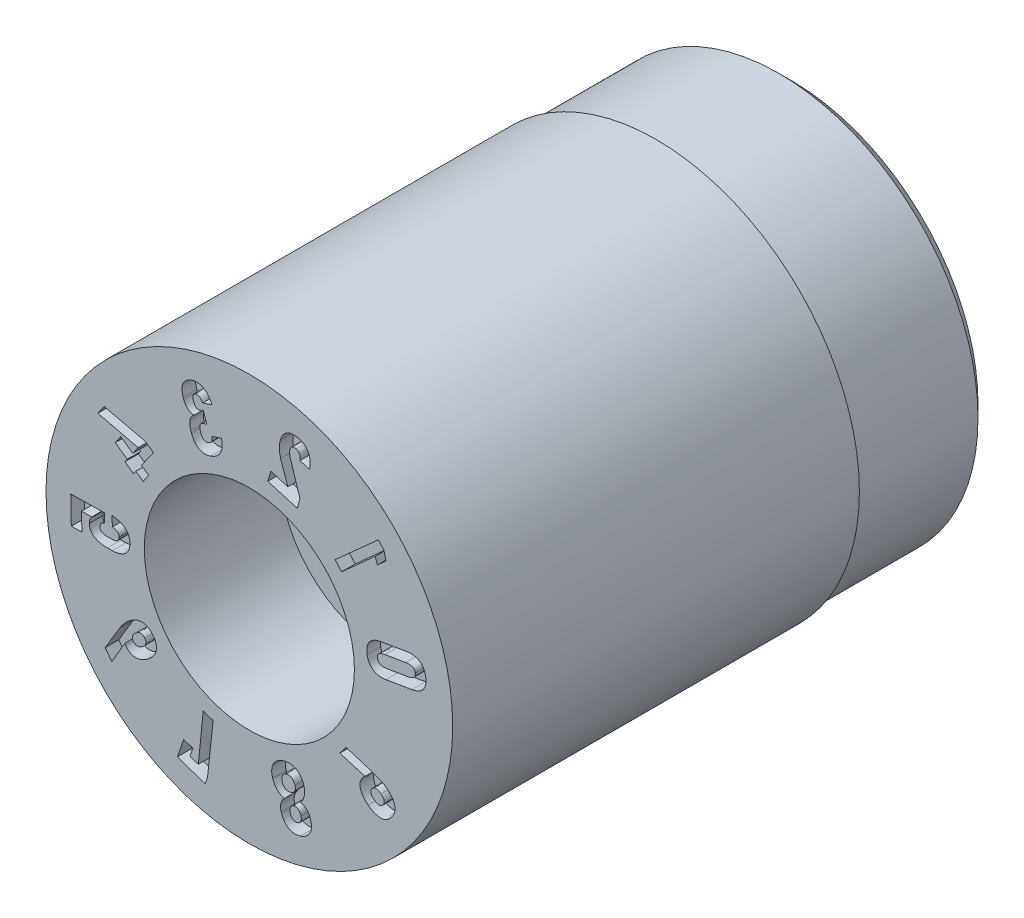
SolidWorks part; units mm, degrees
ref_plane "Front Plane" through (0, 0, 0) normal (0, 0, 1) x (1, 0, 0)
ref_plane "Top Plane" through (0, 0, 0) normal (0, 1, 0) x (1, 0, 0)
ref_plane "Right Plane" through (0, 0, 0) normal (1, 0, 0) x (0, 0, -1)
sketch "Sketch1" plane through (0, 0, 0) normal (1, 0, 0) x (0, 0, -1)
  line L2 (0, 3) -> (0, 1.55)
  line L3 (7.75, 3) -> (0, 3)
  line L4 (-3.7979, 0) -> (49996.2021, 0) construction
  line L8 (8, 0.8) -> (2, 0.8)
  line L9 (2, 1.55) -> (2, 0.8)
  line L10 (2, 1.55) -> (0, 1.55)
  line L12 (8, 0.8) -> (8, 2.75)
  line L16 (8, 2.75) -> (7.75, 3)
  dimension "D1" = 8
  dimension "D2" = 45
  dimension "D3" = 0.25
  dimension "D4" = 6
  dimension "D5" = 3.1
  dimension "D6" = 2
  dimension "D7" = 1.6
revolve "Revolve1" add sketch "Sketch1" angle 360 about L4
sketch "Sketch4" plane through (0, 0, 0) normal (1, 0, 0) x (0, 0, -1)
  line L0 (0, 0) -> (50000, 0) construction
  line L1 (8, -2.75) -> (8, 2.75) construction
  line L2 (6, 3.935) -> (8, 3.935)
  line L3 (6, 3.935) -> (6, 2.935)
  line L4 (6, 2.935) -> (8, 2.935)
  line L5 (8, 3.935) -> (8, 2.935)
  line L6 (7.75, 3) -> (0, 3) construction
  line L9 (0, 55) -> (0, -55) construction
  dimension "D1" = 1
  dimension "D2" = 0.065
  dimension "D3" = 6
revolve "Cut-Revolve1" cut sketch "Sketch4" angle 360 about L0
sketch "Sketch6" plane through (0, 0, 0) normal (0, 0, 1) x (1, 0, 0)
  line L0 (2.0146, 0.1055) -> (2.3985, 0.1693)
  line L1 (2.3238, 0.6173) -> (1.9399, 0.5535)
  line L2 (2.0042, 0.4192) -> (2.3067, 0.4695)
  line L3 (2.3344, 0.3037) -> (2.0318, 0.2534)
  line L4 (1.2659, 1.2629) -> (1.3617, 1.1564)
  line L5 (1.3617, 1.1564) -> (1.8572, 1.6021)
  line L6 (1.8572, 1.6021) -> (1.8898, 1.5069)
  line L7 (1.8898, 1.5069) -> (2.017, 1.6214)
  line L8 (2.017, 1.6214) -> (1.984, 1.7445)
  line L9 (1.984, 1.7445) -> (1.9023, 1.8354)
  line L10 (1.9023, 1.8354) -> (1.2659, 1.2629)
  line L11 (0.7471, 1.7823) -> (0.6045, 2.2294)
  line L12 (0.5981, 2.3405) -> (0.5985, 2.3418)
  line L13 (0.7452, 2.2693) -> (0.745, 2.2687)
  line L14 (0.745, 2.2687) -> (0.8866, 2.2273)
  line L15 (0.8866, 2.2273) -> (0.8868, 2.228)
  line L16 (0.4577, 2.3877) -> (0.4575, 2.387)
  line L17 (0.4616, 2.1553) -> (0.567, 1.8452)
  line L18 (0.567, 1.8452) -> (0.3165, 1.9181)
  line L19 (0.3165, 1.9181) -> (0.2727, 1.7677)
  line L20 (0.2727, 1.7677) -> (0.7061, 1.6415)
  line L21 (0.7061, 1.6415) -> (0.7471, 1.7823)
  line L22 (-0.4143, 1.9759) -> (-0.5539, 1.9282)
  line L23 (-0.7144, 1.8887) -> (-0.721, 1.9077)
  line L24 (-0.6885, 2.0268) -> (-0.6279, 2.0476)
  line L25 (-0.6279, 2.0476) -> (-0.6784, 2.1951)
  line L26 (-0.6784, 2.1951) -> (-0.739, 2.1743)
  line L27 (-0.8213, 2.2398) -> (-0.826, 2.2537)
  line L28 (-0.6895, 2.2872) -> (-0.5503, 2.3348)
  line L29 (-0.9763, 2.2198) -> (-0.968, 2.195)
  line L30 (-0.8618, 1.8465) -> (-0.8533, 1.8218)
  line L31 (-1.5375, 1.3759) -> (-2.1429, 1.5153)
  line L32 (-2.1429, 1.5153) -> (-2.2358, 1.383)
  line L33 (-2.2358, 1.383) -> (-1.6397, 1.2426)
  line L34 (-1.6397, 1.2426) -> (-1.7192, 1.1295)
  line L35 (-1.8355, 0.9639) -> (-1.7082, 0.8747)
  line L36 (-1.7082, 0.8747) -> (-1.6741, 0.9233)
  line L37 (-1.416, 1.2908) -> (-1.5375, 1.3759)
  line L38 (-1.8965, 1.2539) -> (-1.9785, 1.1368)
  line L39 (-1.9785, 1.1368) -> (-1.8013, 1.0125)
  line L40 (-1.5662, 0.8476) -> (-1.4841, 0.9646)
  line L41 (-1.4841, 0.9646) -> (-1.5919, 1.0402)
  line L42 (-2.0239, 0.1805) -> (-2.0244, 0.1805)
  line L43 (-2.0244, 0.1805) -> (-2.0215, 0.038)
  line L44 (-2.0215, 0.038) -> (-2.021, 0.0381)
  line L45 (-2.0242, -0.122) -> (-2.0962, -0.1234)
  line L46 (-2.1379, 0.0281) -> (-2.1406, 0.1613)
  line L47 (-2.1406, 0.1613) -> (-2.6351, 0.1512)
  line L48 (-2.6351, 0.1512) -> (-2.6268, -0.2552)
  line L49 (-2.6268, -0.2552) -> (-2.4707, -0.2519)
  line L50 (-2.4707, -0.2519) -> (-2.476, 0.012)
  line L51 (-2.476, 0.012) -> (-2.324, 0.0152)
  line L52 (-2.0933, -0.2659) -> (-2.0213, -0.2645)
  line L53 (-1.7593, -1.0269) -> (-1.7598, -1.0271)
  line L54 (-1.9203, -1.2119) -> (-2.1265, -1.5571)
  line L55 (-2.1265, -1.5571) -> (-2.0299, -1.6877)
  line L56 (-2.0299, -1.6877) -> (-1.8358, -1.3565)
  line L58 (-1.4966, -1.3877) -> (-1.4961, -1.3873)
  line L59 (-1.5735, -1.2658) -> (-1.574, -1.2662)
  line L60 (-1.6681, -1.1381) -> (-1.6676, -1.1377)
  line L61 (-0.6171, -2.458) -> (-0.5345, -1.6928)
  line L62 (-0.5345, -1.6928) -> (-0.6809, -1.6428)
  line L63 (-0.6809, -1.6428) -> (-0.7525, -2.3604)
  line L64 (-0.7525, -2.3604) -> (-0.8756, -2.3182)
  line L65 (-0.8756, -2.3182) -> (-0.8338, -2.1959)
  line L66 (-0.8338, -2.1959) -> (-0.9689, -2.1498)
  line L67 (-0.9689, -2.1498) -> (-1.0613, -2.4195)
  line L68 (-1.0613, -2.4195) -> (-0.6519, -2.5595)
  line L69 (-0.6519, -2.5595) -> (-0.6171, -2.458)
  line L70 (0.3422, -1.9837) -> (0.3462, -1.9971)
  line L71 (0.4686, -2.3516) -> (0.475, -2.3731)
  line L72 (0.9048, -2.2444) -> (0.8983, -2.2229)
  line L73 (0.8059, -1.8597) -> (0.8018, -1.8462)
  line L74 (0.6721, -1.9095) -> (0.6744, -1.9175)
  line L75 (0.4878, -1.9728) -> (0.4852, -1.9642)
  line L76 (0.7598, -2.2576) -> (0.7621, -2.2655)
  line L77 (0.6057, -2.3119) -> (0.6031, -2.3035)
  line L79 (1.7522, -1.6284) -> (1.7529, -1.6288)
  line L80 (2.0233, -1.2728) -> (2.0226, -1.2724)
  line L81 (1.8037, -1.1717) -> (1.427, -1.054)
  line L82 (1.427, -1.054) -> (1.334, -1.1747)
  line L83 (1.334, -1.1747) -> (1.7071, -1.2847)
  line L84 (1.9409, -1.3912) -> (1.9414, -1.3916)
  line L85 (1.8438, -1.5174) -> (1.8433, -1.5169)
  line L86 (-1.7192, 1.1295) -> (-1.8965, 1.2539)
  line L87 (-1.8013, 1.0125) -> (-1.8355, 0.9639)
  line L88 (-1.5919, 1.0402) -> (-1.416, 1.2908)
  line L89 (-1.6741, 0.9233) -> (-1.5662, 0.8476)
  spline S0 degree 3 poles (1.7376, 0.2895) (1.7404, 0.2722) (1.7463, 0.2472) (1.7584, 0.2162) (1.769, 0.1955) (1.7813, 0.1769) (1.7955, 0.1603) (1.8111, 0.1454) (1.8287, 0.1329) (1.8476, 0.1223) (1.8679, 0.1136) (1.8895, 0.1072) (1.9121, 0.1026) (1.9361, 0.1003) (1.9705, 0.0997) (1.9968, 0.1025) (2.0146, 0.1055) knots 0 0 0 0 0.138609 0.202542 0.263351 0.322176 0.379333 0.435855 0.492619 0.54966 0.607664 0.667011 0.72758 0.790746 0.857219 1 1 1 1
  spline S1 degree 3 poles (2.3985, 0.1693) (2.4164, 0.1726) (2.4426, 0.1781) (2.4751, 0.1901) (2.497, 0.2002) (2.5171, 0.2116) (2.5352, 0.225) (2.5516, 0.2396) (2.5659, 0.2559) (2.5784, 0.2735) (2.5883, 0.2926) (2.5962, 0.3129) (2.6017, 0.3346) (2.605, 0.3575) (2.6062, 0.3907) (2.604, 0.4161) (2.601, 0.4333) knots 0 0 0 0 0.144216 0.210853 0.274107 0.334901 0.39402 0.451854 0.508838 0.565474 0.622094 0.678903 0.737674 0.798508 0.862086 1 1 1 1
  spline S2 degree 3 poles (2.601, 0.4333) (2.5982, 0.4505) (2.5923, 0.4755) (2.5803, 0.5064) (2.5696, 0.527) (2.5575, 0.5458) (2.5436, 0.5626) (2.5279, 0.5773) (2.5106, 0.5901) (2.4918, 0.6007) (2.4717, 0.6095) (2.4502, 0.616) (2.4275, 0.6205) (2.4034, 0.6227) (2.3686, 0.6233) (2.3419, 0.6202) (2.3238, 0.6173) knots 0 0 0 0 0.138369 0.201729 0.262433 0.321042 0.378365 0.434789 0.490925 0.547561 0.605122 0.663992 0.724856 0.788333 0.855125 1 1 1 1
  spline S3 degree 3 poles (1.9399, 0.5535) (1.9219, 0.5506) (1.896, 0.5444) (1.8633, 0.5328) (1.8414, 0.5227) (1.8214, 0.5111) (1.8032, 0.4977) (1.7868, 0.4831) (1.7725, 0.4667) (1.7602, 0.449) (1.75, 0.43) (1.7424, 0.4096) (1.737, 0.388) (1.7337, 0.3652) (1.732, 0.332) (1.7349, 0.3066) (1.7376, 0.2895) knots 0 0 0 0 0.144225 0.210871 0.274142 0.335041 0.394175 0.452024 0.509023 0.565947 0.622266 0.679445 0.737977 0.798415 0.862179 1 1 1 1
  spline S4 degree 3 poles (1.8909, 0.3151) (1.8889, 0.3277) (1.8889, 0.3474) (1.9003, 0.3702) (1.9133, 0.3843) (1.9304, 0.3961) (1.9603, 0.4101) (1.986, 0.4159) (2.0042, 0.4192) knots 0 0 0 0 0.222979 0.324818 0.432128 0.549721 0.681516 1 1 1 1
  spline S5 degree 3 poles (2.3067, 0.4695) (2.3249, 0.4726) (2.3511, 0.4749) (2.384, 0.4718) (2.4011, 0.4669) (2.413, 0.4614) (2.4207, 0.4564) (2.4276, 0.4505) (2.4337, 0.4438) (2.4385, 0.4359) (2.4441, 0.4242) (2.4468, 0.4146) (2.4478, 0.4079) knots 0 0 0 0 0.31775 0.449993 0.566884 0.621636 0.673932 0.725322 0.777608 0.829312 0.882944 1 1 1 1
  spline S6 degree 3 poles (2.4478, 0.4079) (2.4497, 0.3953) (2.45, 0.3754) (2.4382, 0.3528) (2.4253, 0.3386) (2.4082, 0.3268) (2.3782, 0.3129) (2.3526, 0.3066) (2.3344, 0.3037) knots 0 0 0 0 0.222795 0.325269 0.43249 0.549986 0.681672 1 1 1 1
  spline S7 degree 3 poles (2.0318, 0.2534) (2.0137, 0.2501) (1.9875, 0.2479) (1.9545, 0.2509) (1.9375, 0.256) (1.9256, 0.2615) (1.9179, 0.2665) (1.911, 0.2723) (1.905, 0.2792) (1.9002, 0.287) (1.8946, 0.2987) (1.892, 0.3083) (1.8909, 0.3151) knots 0 0 0 0 0.317529 0.449767 0.567235 0.621985 0.674279 0.725667 0.776639 0.829319 0.882949 1 1 1 1
  spline S8 degree 3 poles (0.6045, 2.2294) (0.598, 2.2484) (0.5909, 2.2857) (0.5933, 2.3236) (0.5981, 2.3405) knots 0 0 0 0 0.534247 1 1 1 1
  spline S9 degree 3 poles (0.5985, 2.3418) (0.6012, 2.3519) (0.6077, 2.3659) (0.6209, 2.3807) (0.6325, 2.3884) (0.6457, 2.3933) (0.666, 2.3964) (0.6819, 2.393) (0.6924, 2.3902) knots 0 0 0 0 0.261267 0.378259 0.491228 0.605842 0.725733 1 1 1 1
  spline S10 degree 3 poles (0.6924, 2.3902) (0.7031, 2.3874) (0.718, 2.3796) (0.7331, 2.3633) (0.7411, 2.3486) (0.7464, 2.3316) (0.75, 2.3049) (0.7478, 2.2838) (0.7452, 2.2693) knots 0 0 0 0 0.227549 0.335372 0.449552 0.569521 0.698703 1 1 1 1
  spline S11 degree 3 poles (0.8868, 2.228) (0.8923, 2.2527) (0.8981, 2.2894) (0.8976, 2.3376) (0.8934, 2.3707) (0.8856, 2.4016) (0.8744, 2.4301) (0.8594, 2.4558) (0.8412, 2.479) (0.8196, 2.4992) (0.7861, 2.5225) (0.7573, 2.5345) (0.7372, 2.5403) knots 0 0 0 0 0.196419 0.286379 0.372568 0.454609 0.533178 0.609155 0.684941 0.760994 0.837616 1 1 1 1
  spline S12 degree 3 poles (0.7372, 2.5403) (0.716, 2.5466) (0.684, 2.5529) (0.6419, 2.5535) (0.6129, 2.5498) (0.5857, 2.5423) (0.5604, 2.5312) (0.5373, 2.516) (0.5164, 2.4973) (0.4978, 2.4749) (0.4755, 2.4393) (0.464, 2.4089) (0.4577, 2.3877) knots 0 0 0 0 0.183992 0.267932 0.348004 0.425466 0.500914 0.576307 0.653235 0.732785 0.816526 1 1 1 1
  spline S13 degree 3 poles (0.4575, 2.387) (0.4522, 2.3682) (0.4458, 2.3394) (0.4424, 2.3) (0.4421, 2.2701) (0.4434, 2.2404) (0.4487, 2.2017) (0.4555, 2.1735) (0.4616, 2.1553) knots 0 0 0 0 0.249446 0.375439 0.503252 0.630424 0.75523 1 1 1 1
  spline S14 degree 3 poles (-0.5662, 1.6698) (-0.5456, 1.677) (-0.516, 1.6903) (-0.4815, 1.7149) (-0.4592, 1.7358) (-0.44, 1.759) (-0.4246, 1.7846) (-0.4127, 1.8124) (-0.4048, 1.8423) (-0.4007, 1.8739) (-0.401, 1.9192) (-0.4076, 1.9533) (-0.4143, 1.9759) knots 0 0 0 0 0.171218 0.25238 0.331984 0.41001 0.487611 0.565757 0.646215 0.72948 0.815076 1 1 1 1
  spline S15 degree 3 poles (-0.5539, 1.9282) (-0.5523, 1.9199) (-0.5504, 1.9078) (-0.5507, 1.8919) (-0.552, 1.881) (-0.5545, 1.8708) (-0.5583, 1.8614) (-0.563, 1.8528) (-0.5687, 1.845) (-0.5756, 1.8381) (-0.5864, 1.83) (-0.5958, 1.8258) (-0.6022, 1.8235) knots 0 0 0 0 0.197705 0.287546 0.372977 0.4551 0.533273 0.609529 0.685153 0.761273 0.838169 1 1 1 1
  spline S16 degree 3 poles (-0.6022, 1.8235) (-0.6138, 1.8193) (-0.6318, 1.8163) (-0.6551, 1.8201) (-0.6706, 1.827) (-0.6844, 1.8375) (-0.7016, 1.8569) (-0.7097, 1.8756) (-0.7144, 1.8887) knots 0 0 0 0 0.250747 0.363671 0.47608 0.592198 0.715111 1 1 1 1
  spline S17 degree 3 poles (-0.721, 1.9077) (-0.7256, 1.9215) (-0.7309, 1.9417) (-0.7316, 1.968) (-0.729, 1.9846) (-0.7235, 1.9993) (-0.7116, 2.0158) (-0.698, 2.0235) (-0.6885, 2.0268) knots 0 0 0 0 0.314858 0.445549 0.566053 0.676389 0.780184 1 1 1 1
  spline S18 degree 3 poles (-0.739, 2.1743) (-0.7468, 2.1714) (-0.7596, 2.1702) (-0.7757, 2.1754) (-0.7868, 2.1827) (-0.7971, 2.193) (-0.8102, 2.2114) (-0.8173, 2.228) (-0.8213, 2.2398) knots 0 0 0 0 0.211756 0.314428 0.424926 0.546445 0.681798 1 1 1 1
  spline S19 degree 3 poles (-0.826, 2.2537) (-0.8298, 2.2648) (-0.834, 2.2813) (-0.8338, 2.303) (-0.8308, 2.3168) (-0.8255, 2.329) (-0.8144, 2.3429) (-0.8024, 2.3495) (-0.7938, 2.3523) knots 0 0 0 0 0.302293 0.43097 0.549865 0.661575 0.76929 1 1 1 1
  spline S20 degree 3 poles (-0.7938, 2.3523) (-0.788, 2.3546) (-0.7786, 2.3558) (-0.766, 2.3551) (-0.7566, 2.353) (-0.7473, 2.3496) (-0.7382, 2.3447) (-0.7293, 2.3384) (-0.7206, 2.3308) (-0.7121, 2.3219) (-0.7012, 2.3076) (-0.694, 2.2957) (-0.6895, 2.2872) knots 0 0 0 0 0.139786 0.209269 0.280741 0.354739 0.430798 0.511438 0.598094 0.68876 0.7855 1 1 1 1
  spline S21 degree 3 poles (-0.5503, 2.3348) (-0.5602, 2.3575) (-0.5772, 2.3898) (-0.606, 2.4273) (-0.6288, 2.4513) (-0.6534, 2.4712) (-0.6791, 2.4876) (-0.7062, 2.4996) (-0.7342, 2.5077) (-0.7629, 2.5117) (-0.8019, 2.5116) (-0.8308, 2.5055) (-0.8495, 2.499) knots 0 0 0 0 0.196281 0.287022 0.374088 0.45775 0.537568 0.614828 0.691684 0.767965 0.84353 1 1 1 1
  spline S22 degree 3 poles (-0.8495, 2.499) (-0.8645, 2.4937) (-0.886, 2.4847) (-0.9121, 2.4694) (-0.9293, 2.4569) (-0.9443, 2.4429) (-0.9576, 2.4278) (-0.969, 2.4114) (-0.9782, 2.3937) (-0.9855, 2.375) (-0.9905, 2.3554) (-0.9937, 2.3349) (-0.9944, 2.3135) (-0.993, 2.2913) (-0.9886, 2.2595) (-0.9819, 2.2357) (-0.9763, 2.2198) knots 0 0 0 0 0.13652 0.199806 0.260089 0.318559 0.37588 0.432741 0.489598 0.547044 0.6047 0.663664 0.724621 0.788557 0.855145 1 1 1 1
  spline S23 degree 3 poles (-0.968, 2.195) (-0.9618, 2.1774) (-0.9502, 2.152) (-0.9282, 2.1232) (-0.9096, 2.105) (-0.889, 2.0901) (-0.8586, 2.0746) (-0.8335, 2.0687) (-0.8164, 2.0673) knots 0 0 0 0 0.267259 0.393105 0.515919 0.636696 0.755619 1 1 1 1
  spline S24 degree 3 poles (-0.8164, 2.0673) (-0.8239, 2.0622) (-0.8347, 2.0538) (-0.8468, 2.0404) (-0.8549, 2.0298) (-0.8617, 2.0181) (-0.8673, 2.0057) (-0.8721, 1.9925) (-0.8756, 1.9785) (-0.8778, 1.9638) (-0.8792, 1.9485) (-0.8791, 1.9328) (-0.8781, 1.9164) (-0.8758, 1.8996) (-0.8711, 1.876) (-0.8658, 1.8583) (-0.8618, 1.8465) knots 0 0 0 0 0.112274 0.166991 0.222094 0.276289 0.332234 0.389462 0.448853 0.509882 0.572455 0.637014 0.703805 0.77371 0.846042 1 1 1 1
  spline S25 degree 3 poles (-0.8533, 1.8218) (-0.8458, 1.7997) (-0.8321, 1.7686) (-0.8079, 1.7318) (-0.788, 1.7089) (-0.7661, 1.6897) (-0.7422, 1.6745) (-0.7163, 1.6635) (-0.6889, 1.6563) (-0.6599, 1.6533) (-0.6182, 1.6552) (-0.5869, 1.6626) (-0.5662, 1.6698) knots 0 0 0 0 0.18918 0.274847 0.356631 0.435017 0.510694 0.586123 0.66227 0.740496 0.822165 1 1 1 1
  spline S26 degree 3 poles (-1.762, -0.0359) (-1.7624, -0.0165) (-1.7663, 0.0126) (-1.7804, 0.0485) (-1.7942, 0.0735) (-1.8117, 0.0964) (-1.8329, 0.1168) (-1.8575, 0.1347) (-1.8853, 0.1501) (-1.9161, 0.1624) (-1.9621, 0.1755) (-1.9988, 0.1795) (-2.0239, 0.1805) knots 0 0 0 0 0.154698 0.229603 0.304852 0.380725 0.457448 0.537586 0.621218 0.708761 0.800522 1 1 1 1
  spline S27 degree 3 poles (-2.021, 0.0381) (-2.0067, 0.0371) (-1.9863, 0.0338) (-1.9617, 0.024) (-1.9469, 0.0146) (-1.9347, 0.0033) (-1.9231, -0.0147) (-1.9192, -0.0305) (-1.9193, -0.0412) knots 0 0 0 0 0.301165 0.43072 0.553236 0.667758 0.776115 1 1 1 1
  spline S28 degree 3 poles (-1.9193, -0.0412) (-1.9191, -0.0525) (-1.9217, -0.0696) (-1.9334, -0.0888) (-1.9458, -0.1004) (-1.9612, -0.1098) (-1.9872, -0.1196) (-2.0091, -0.1214) (-2.0242, -0.122) knots 0 0 0 0 0.227496 0.334815 0.446114 0.565812 0.694478 1 1 1 1
  spline S29 degree 3 poles (-2.0962, -0.1234) (-2.1114, -0.124) (-2.133, -0.1225) (-2.1594, -0.1151) (-2.1751, -0.1073) (-2.1877, -0.0973) (-2.2001, -0.0808) (-2.2037, -0.0655) (-2.2038, -0.0553) knots 0 0 0 0 0.317975 0.451282 0.571973 0.683103 0.78541 1 1 1 1
  spline S30 degree 3 poles (-2.2038, -0.0553) (-2.2041, -0.0457) (-2.2021, -0.0314) (-2.195, -0.014) (-2.1873, -0.0024) (-2.1777, 0.008) (-2.1616, 0.0194) (-2.148, 0.0257) (-2.1379, 0.0281) knots 0 0 0 0 0.249818 0.368942 0.488861 0.610437 0.733236 1 1 1 1
  spline S31 degree 3 poles (-2.324, 0.0152) (-2.3301, 0.0095) (-2.338, -0.0007) (-2.3463, -0.0163) (-2.3567, -0.0425) (-2.3607, -0.0662) (-2.3604, -0.0851) knots 0 0 0 0 0.227729 0.350589 0.48256 1 1 1 1
  spline S32 degree 3 poles (-2.3604, -0.0851) (-2.3598, -0.1035) (-2.3563, -0.1308) (-2.3422, -0.1637) (-2.3282, -0.1857) (-2.3104, -0.2053) (-2.2889, -0.2221) (-2.2641, -0.2364) (-2.2358, -0.2477) (-2.2045, -0.2565) (-2.1568, -0.2653) (-2.1191, -0.2661) (-2.0933, -0.2659) knots 0 0 0 0 0.152217 0.223264 0.294076 0.366246 0.44003 0.518216 0.601427 0.690703 0.786539 1 1 1 1
  spline S33 degree 3 poles (-2.0213, -0.2645) (-1.9954, -0.2638) (-1.9577, -0.2606) (-1.9105, -0.2484) (-1.8795, -0.2361) (-1.8517, -0.2211) (-1.8275, -0.2027) (-1.8068, -0.1815) (-1.79, -0.1574) (-1.7767, -0.1306) (-1.7642, -0.0904) (-1.7616, -0.0579) (-1.762, -0.0359) knots 0 0 0 0 0.19821 0.287931 0.372209 0.452593 0.52937 0.60401 0.678325 0.753762 0.831271 1 1 1 1
  spline S34 degree 3 poles (-1.4176, -1.0512) (-1.4309, -1.0337) (-1.4524, -1.0094) (-1.4868, -0.9852) (-1.5134, -0.9718) (-1.5413, -0.9629) (-1.5704, -0.9585) (-1.6005, -0.9589) (-1.6315, -0.9635) (-1.6631, -0.9727) (-1.7072, -0.9918) (-1.7389, -1.0115) (-1.7593, -1.0269) knots 0 0 0 0 0.169313 0.247571 0.323455 0.398288 0.472554 0.549541 0.629387 0.713781 0.80272 1 1 1 1
  spline S35 degree 3 poles (-1.7598, -1.0271) (-1.7728, -1.0366) (-1.7916, -1.0525) (-1.8157, -1.0754) (-1.8526, -1.1142) (-1.8803, -1.15) (-1.9005, -1.1802) knots 0 0 0 0 0.231348 0.352667 0.477588 1 1 1 1
  spline S36 degree 3 poles (-1.9005, -1.1802) (-1.9039, -1.1856) (-1.911, -1.1958) (-1.9172, -1.2066) (-1.9203, -1.2119) knots 0 0 0 0 0.507542 1 1 1 1
  spline S37 degree 3 poles (-1.8358, -1.3565) (-1.8321, -1.3652) (-1.8272, -1.3733) (-1.8216, -1.381) knots 0.76417 0.76417 0.76417 0.76417 1 1 1 1
  spline S38 degree 3 poles (-1.8216, -1.381) (-1.8098, -1.3966) (-1.7901, -1.4182) (-1.7584, -1.4391) (-1.7336, -1.4502) (-1.7074, -1.4571) (-1.6799, -1.4597) (-1.6512, -1.4582) (-1.6215, -1.4522) (-1.5909, -1.4422) (-1.5478, -1.4225) (-1.5169, -1.4027) (-1.4966, -1.3877) knots 0 0 0 0 0.160702 0.235164 0.308132 0.381069 0.455431 0.53243 0.614474 0.701692 0.794182 1 1 1 1
  spline S39 degree 3 poles (-1.4961, -1.3873) (-1.4755, -1.3719) (-1.4469, -1.3475) (-1.4155, -1.3103) (-1.3972, -1.2825) (-1.3832, -1.2541) (-1.3739, -1.2252) (-1.3694, -1.1959) (-1.3698, -1.1665) (-1.3745, -1.137) (-1.388, -1.0969) (-1.4043, -1.0688) (-1.4176, -1.0512) knots 0 0 0 0 0.197264 0.286684 0.3715 0.45168 0.528644 0.602805 0.677381 0.75322 0.830929 1 1 1 1
  spline S40 degree 3 poles (-1.5434, -1.1443) (-1.5362, -1.1534) (-1.5286, -1.1688) (-1.5258, -1.191) (-1.5281, -1.2071) (-1.5338, -1.223) (-1.5478, -1.2442) (-1.5624, -1.2577) (-1.5735, -1.2658) knots 0 0 0 0 0.244263 0.354808 0.467435 0.583631 0.709108 1 1 1 1
  spline S41 degree 3 poles (-1.574, -1.2662) (-1.5867, -1.2758) (-1.6062, -1.2875) (-1.6335, -1.2969) (-1.6519, -1.2991) (-1.6693, -1.2976) (-1.6908, -1.2894) (-1.7038, -1.2775) (-1.7106, -1.2681) knots 0 0 0 0 0.308468 0.43893 0.557953 0.667998 0.773854 1 1 1 1
  spline S42 degree 3 poles (-1.7106, -1.2681) (-1.7172, -1.2588) (-1.7252, -1.2431) (-1.726, -1.2201) (-1.7223, -1.203) (-1.7146, -1.1859) (-1.6976, -1.1627) (-1.681, -1.1473) (-1.6681, -1.1381) knots 0 0 0 0 0.223885 0.330037 0.442005 0.56238 0.692983 1 1 1 1
  spline S43 degree 3 poles (-1.6676, -1.1377) (-1.6565, -1.1297) (-1.6395, -1.1192) (-1.6151, -1.1125) (-1.5984, -1.1115) (-1.5826, -1.1143) (-1.5623, -1.1231) (-1.5502, -1.1353) (-1.5434, -1.1443) knots 0 0 0 0 0.293386 0.41788 0.534255 0.646942 0.757015 1 1 1 1
  spline S44 degree 3 poles (0.5037, -1.687) (0.4821, -1.6934) (0.451, -1.7061) (0.4147, -1.7303) (0.3912, -1.7508) (0.371, -1.7736) (0.3549, -1.7989) (0.3424, -1.8261) (0.3341, -1.8553) (0.3297, -1.886) (0.3293, -1.9295) (0.3358, -1.9622) (0.3422, -1.9837) knots 0 0 0 0 0.178257 0.262079 0.34343 0.423207 0.501347 0.579164 0.658541 0.739777 0.823061 1 1 1 1
  spline S45 degree 3 poles (0.3462, -1.9971) (0.3521, -2.0173) (0.3651, -2.0461) (0.3889, -2.0809) (0.4103, -2.1042) (0.4338, -2.1247) (0.4677, -2.1468) (0.4957, -2.1579) (0.5151, -2.1619) knots 0 0 0 0 0.254578 0.381676 0.510289 0.637927 0.760316 1 1 1 1
  spline S46 degree 3 poles (0.5151, -2.1619) (0.5035, -2.174) (0.4877, -2.1941) (0.4738, -2.2252) (0.466, -2.25) (0.4613, -2.2756) (0.4597, -2.3098) (0.4635, -2.3353) (0.4686, -2.3516) knots 0 0 0 0 0.246336 0.370671 0.497933 0.625804 0.75091 1 1 1 1
  spline S47 degree 3 poles (0.475, -2.3731) (0.481, -2.3935) (0.493, -2.4224) (0.5157, -2.4565) (0.5349, -2.4786) (0.5567, -2.4972) (0.5804, -2.5124) (0.6062, -2.524) (0.6336, -2.5319) (0.6625, -2.5361) (0.7034, -2.5362) (0.7341, -2.5301) (0.7544, -2.5241) knots 0 0 0 0 0.177662 0.260975 0.342618 0.422186 0.500506 0.578272 0.658218 0.739451 0.822498 1 1 1 1
  spline S48 degree 3 poles (0.7544, -2.5241) (0.7747, -2.5181) (0.8037, -2.5061) (0.8378, -2.4834) (0.8597, -2.4642) (0.8782, -2.4426) (0.8933, -2.4188) (0.9048, -2.3931) (0.9126, -2.3655) (0.9167, -2.3365) (0.9166, -2.2956) (0.9109, -2.2647) (0.9048, -2.2444) knots 0 0 0 0 0.177677 0.260997 0.342161 0.421735 0.499167 0.577616 0.657197 0.738803 0.822266 1 1 1 1
  spline S49 degree 3 poles (0.8983, -2.2229) (0.8934, -2.2063) (0.8826, -2.1826) (0.8623, -2.1546) (0.844, -2.136) (0.8238, -2.1196) (0.7945, -2.102) (0.7703, -2.0937) (0.7538, -2.0903) knots 0 0 0 0 0.251562 0.376087 0.503572 0.630735 0.754573 1 1 1 1
  spline S50 degree 3 poles (0.7538, -2.0903) (0.7675, -2.076) (0.7855, -2.0515) (0.8018, -2.0142) (0.8107, -1.9841) (0.8157, -1.953) (0.8174, -1.9109) (0.8116, -1.8798) (0.8059, -1.8597) knots 0 0 0 0 0.241289 0.364268 0.491404 0.620226 0.746191 1 1 1 1
  spline S51 degree 3 poles (0.8018, -1.8462) (0.7957, -1.8245) (0.7825, -1.794) (0.7589, -1.7576) (0.7383, -1.7344) (0.7153, -1.7146) (0.6899, -1.6986) (0.6625, -1.6863) (0.6331, -1.6782) (0.6021, -1.674) (0.5583, -1.6742) (0.5254, -1.6803) (0.5037, -1.687) knots 0 0 0 0 0.177147 0.259976 0.340867 0.420384 0.498645 0.576255 0.656166 0.738024 0.821749 1 1 1 1
  spline S52 degree 3 poles (0.5484, -1.8357) (0.5571, -1.8332) (0.5704, -1.8306) (0.5881, -1.8313) (0.6008, -1.8337) (0.613, -1.8377) (0.6243, -1.8436) (0.6351, -1.8508) (0.6448, -1.8599) (0.6536, -1.8702) (0.6635, -1.8866) (0.6696, -1.8999) (0.6721, -1.9095) knots 0 0 0 0 0.168153 0.248105 0.32777 0.406428 0.485018 0.564669 0.646104 0.730071 0.816746 1 1 1 1
  spline S53 degree 3 poles (0.6744, -1.9175) (0.677, -1.9262) (0.6795, -1.9394) (0.6794, -1.9571) (0.6775, -1.9695) (0.6739, -1.9813) (0.669, -1.9925) (0.6624, -2.0027) (0.6543, -2.012) (0.6449, -2.0204) (0.6301, -2.03) (0.6177, -2.0353) (0.6089, -2.0378) knots 0 0 0 0 0.17699 0.260518 0.34178 0.421664 0.499849 0.578199 0.657344 0.738829 0.82179 1 1 1 1
  spline S54 degree 3 poles (0.6089, -2.0378) (0.6001, -2.0406) (0.5868, -2.0429) (0.5691, -2.0432) (0.5567, -2.0412) (0.5447, -2.038) (0.5335, -2.0328) (0.5232, -2.0263) (0.5139, -2.018) (0.5053, -2.0087) (0.4955, -1.994) (0.4903, -1.9815) (0.4878, -1.9728) knots 0 0 0 0 0.177456 0.260073 0.341903 0.421387 0.500264 0.578347 0.658314 0.740807 0.823495 1 1 1 1
  spline S55 degree 3 poles (0.4852, -1.9642) (0.4824, -1.9547) (0.4797, -1.9405) (0.4792, -1.9215) (0.481, -1.9081) (0.484, -1.8953) (0.4889, -1.8834) (0.4955, -1.8725) (0.5035, -1.8626) (0.5129, -1.8539) (0.5272, -1.8435) (0.5397, -1.8384) (0.5484, -1.8357) knots 0 0 0 0 0.183451 0.26871 0.352996 0.434742 0.513942 0.592426 0.671355 0.750907 0.830533 1 1 1 1
  spline S56 degree 3 poles (0.6537, -2.1879) (0.6612, -2.1856) (0.6726, -2.1839) (0.6877, -2.1846) (0.6985, -2.187) (0.7088, -2.1908) (0.7184, -2.1964) (0.7276, -2.2031) (0.7358, -2.2117) (0.7432, -2.2214) (0.7522, -2.2364) (0.7571, -2.2489) (0.7598, -2.2576) knots 0 0 0 0 0.163774 0.240232 0.317594 0.395043 0.470906 0.550614 0.6333 0.719563 0.808143 1 1 1 1
  spline S57 degree 3 poles (0.7621, -2.2655) (0.7645, -2.2737) (0.7673, -2.286) (0.7675, -2.3023) (0.7665, -2.3137) (0.7639, -2.3246) (0.7597, -2.3346) (0.7547, -2.344) (0.7481, -2.3525) (0.7402, -2.3601) (0.7278, -2.3687) (0.7172, -2.3732) (0.7098, -2.3753) knots 0 0 0 0 0.186588 0.272772 0.356426 0.436924 0.515999 0.592628 0.671059 0.750298 0.830877 1 1 1 1
  spline S58 degree 3 poles (0.7098, -2.3753) (0.7024, -2.3777) (0.6911, -2.3796) (0.6761, -2.3792) (0.6654, -2.3772) (0.6552, -2.3739) (0.6456, -2.3689) (0.6368, -2.3625) (0.6287, -2.3547) (0.6216, -2.3456) (0.6126, -2.3318) (0.6082, -2.32) (0.6057, -2.3119) knots 0 0 0 0 0.168997 0.248666 0.326295 0.404426 0.48215 0.561316 0.642434 0.727012 0.813804 1 1 1 1
  spline S59 degree 3 poles (0.6031, -2.3035) (0.6005, -2.2949) (0.5979, -2.282) (0.5971, -2.2648) (0.5983, -2.2527) (0.6006, -2.2412) (0.6043, -2.2306) (0.6092, -2.2206) (0.6158, -2.2118) (0.6235, -2.2039) (0.6356, -2.1947) (0.6463, -2.1902) (0.6537, -2.1879) knots 0 0 0 0 0.190008 0.27827 0.363668 0.445898 0.525325 0.602356 0.680256 0.757416 0.835512 1 1 1 1
  spline S60 degree 3 poles (1.7071, -1.2847) (1.7065, -1.2851) (1.7015, -1.2884) (1.6878, -1.299) (1.6766, -1.3114) (1.6696, -1.3203) knots 0.575605 0.575605 0.575605 0.575605 0.592823 0.721986 1 1 1 1
  spline S61 degree 3 poles (1.6696, -1.3203) (1.6582, -1.3347) (1.6448, -1.3587) (1.6349, -1.3935) (1.6321, -1.4201) (1.6333, -1.4473) (1.6385, -1.4746) (1.6481, -1.5018) (1.6615, -1.5289) (1.6787, -1.5555) (1.7076, -1.5905) (1.7335, -1.6139) (1.7522, -1.6284) knots 0 0 0 0 0.154177 0.227629 0.302335 0.378161 0.455372 0.535064 0.619634 0.708375 0.80058 1 1 1 1
  spline S62 degree 3 poles (1.7529, -1.6288) (1.7735, -1.6446) (1.8051, -1.6657) (1.8497, -1.6859) (1.8816, -1.6959) (1.9128, -1.7014) (1.9431, -1.7025) (1.9726, -1.6987) (2.0009, -1.6905) (2.0281, -1.6778) (2.0631, -1.654) (2.0854, -1.6303) (2.0989, -1.6128) knots 0 0 0 0 0.198698 0.2881 0.372833 0.452826 0.529136 0.60379 0.678265 0.75391 0.831316 1 1 1 1
  spline S63 degree 3 poles (2.0989, -1.6128) (2.1125, -1.5955) (2.1292, -1.5677) (2.1432, -1.5278) (2.1484, -1.4983) (2.1488, -1.4687) (2.1444, -1.4392) (2.1355, -1.4098) (2.1219, -1.3808) (2.1037, -1.3524) (2.0724, -1.3143) (2.0442, -1.2886) (2.0233, -1.2728) knots 0 0 0 0 0.167033 0.24447 0.319743 0.393947 0.468554 0.545392 0.626107 0.71132 0.80092 1 1 1 1
  spline S64 degree 3 poles (2.0226, -1.2724) (2.0108, -1.2632) (1.9915, -1.2503) (1.964, -1.235) (1.9416, -1.2236) (1.9174, -1.2131) (1.8827, -1.1984) (1.8554, -1.1888) (1.8367, -1.1824) knots 0 0 0 0 0.217461 0.333958 0.454837 0.581625 0.714772 1 1 1 1
  spline S65 degree 3 poles (1.8367, -1.1824) (1.8312, -1.1805) (1.8204, -1.1763) (1.8093, -1.1731) (1.8037, -1.1717) knots 0 0 0 0 0.500378 1 1 1 1
  spline S66 degree 3 poles (1.8085, -1.3895) (1.8154, -1.3803) (1.8284, -1.3688) (1.8497, -1.3608) (1.8667, -1.3592) (1.8845, -1.3616) (1.9107, -1.3702) (1.9289, -1.3822) (1.9409, -1.3912) knots 0 0 0 0 0.230374 0.338671 0.450189 0.568973 0.697015 1 1 1 1
  spline S67 degree 3 poles (1.9414, -1.3916) (1.9528, -1.4005) (1.9684, -1.4146) (1.9826, -1.4371) (1.9889, -1.4534) (1.991, -1.4699) (1.9889, -1.4922) (1.9805, -1.5074) (1.9735, -1.5164) knots 0 0 0 0 0.29863 0.425574 0.543937 0.655416 0.764545 1 1 1 1
  spline S68 degree 3 poles (1.9735, -1.5164) (1.9667, -1.5259) (1.9537, -1.5374) (1.9327, -1.5457) (1.9161, -1.5476) (1.8985, -1.5456) (1.8731, -1.5375) (1.8553, -1.5261) (1.8438, -1.5174) knots 0 0 0 0 0.237457 0.345518 0.457578 0.575042 0.70318 1 1 1 1
  spline S69 degree 3 poles (1.8433, -1.5169) (1.8314, -1.5078) (1.8156, -1.4931) (1.8003, -1.4703) (1.7939, -1.4535) (1.7911, -1.4368) (1.7934, -1.4142) (1.8012, -1.3985) (1.8085, -1.3895) knots 0 0 0 0 0.301578 0.429917 0.547918 0.658796 0.766426 1 1 1 1
extrude "Cut-Extrude1" cut sketch "Sketch6" against normal blind 0.2
